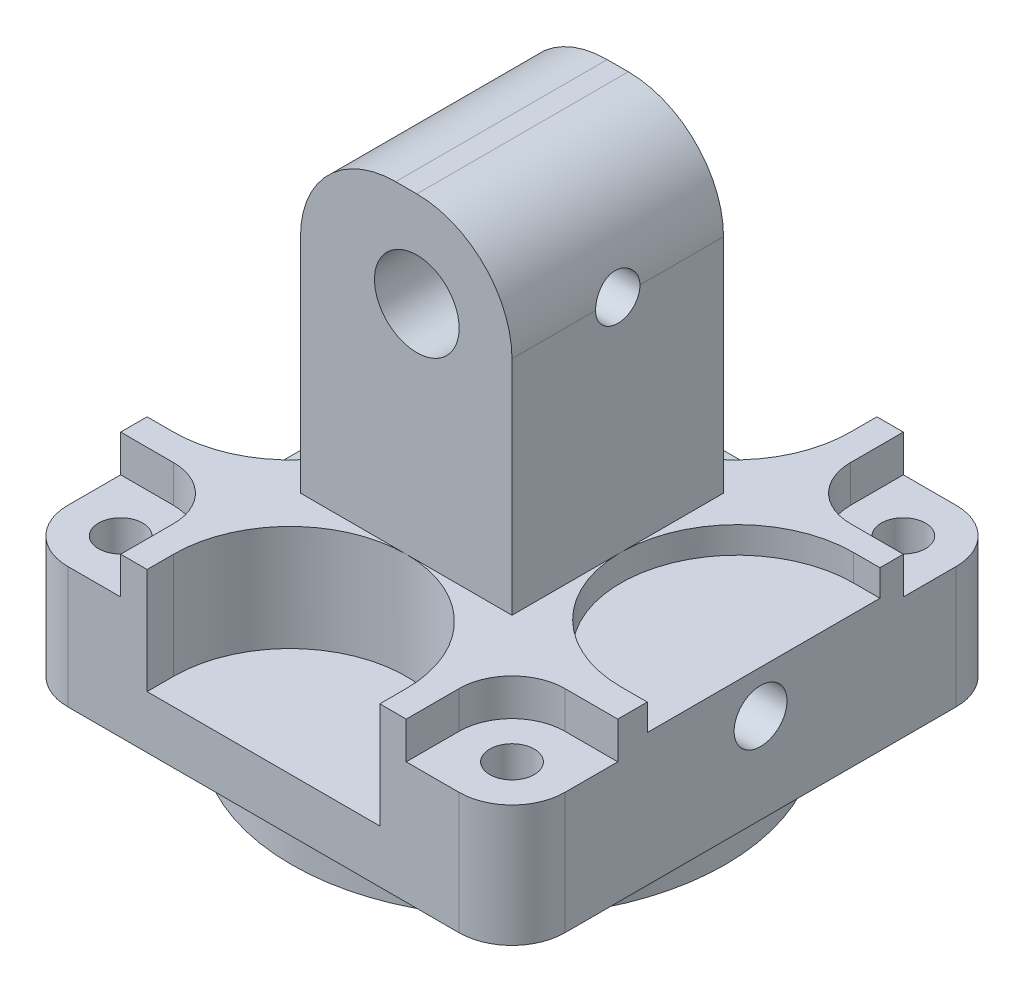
SolidWorks part; units mm, degrees
ref_plane "Plan de face" through (0, 0, 0) normal (0, 0, 1) x (1, 0, 0)
ref_plane "Plan de dessus" through (0, 0, 0) normal (0, 1, 0) x (1, 0, 0)
ref_plane "Plan de droite" through (0, 0, 0) normal (1, 0, 0) x (0, 0, -1)
sketch "Esquisse1" plane through (0, 0, 0) normal (0, 0, 1) x (1, 0, 0)
  line L1 (-23.5, 15) -> (23.5, 15)
  line L2 (-23.5, 15) -> (-23.5, 0)
  line L3 (-23.5, 0) -> (23.5, 0)
  line L4 (23.5, 15) -> (23.5, 0)
  dimension "D1" = 47
  dimension "D2" = 23.5
  dimension "D3" = 15
extrude "Extrusion1" add sketch "Esquisse1" along normal blind 47
sketch "Esquisse2" plane through (0, 0, 0) normal (0, -1, 0) x (1, 0, 0)
  circle A0 centre (0, 23.8473) radius 20.5
  dimension "D1" = 41
extrude "Extrusion2" add sketch "Esquisse2" along normal blind 5
sketch "Esquisse3" plane through (0, -5, 0) normal (0, -1, 0) x (1, 0, 0)
  circle A0 centre (0, 23.8473) radius 9.75
  dimension "D1" = 19.5
extrude "Extrusion3" add sketch "Esquisse3" along normal blind 3.5
sketch "Esquisse9" plane through (0, 15, 0) normal (0, 1, 0) x (-1, 0, 0)
  line L0 (0, -5.7773) -> (0, 143.899) construction
  line L1 (0, 23.5) -> (-77.8064, 23.5) construction
  line L2 (11, 2.5) -> (11, 0)
  line L3 (-11, 2.5) -> (-11, 0)
  line L4 (0, 23.5) -> (84.5721, 23.5) construction
  line L5 (-23.5, 0) -> (23.5, 0) construction
  line L6 (-11, 0) -> (11, 0)
  line L8 (-11, 44.5) -> (-11, 47)
  line L9 (21, 34.5) -> (23.5, 34.5)
  line L10 (-23.5, 47) -> (23.5, 47) construction
  line L11 (23.5, 47) -> (23.5, 0) construction
  line L12 (21, 12.5) -> (23.5, 12.5)
  line L13 (-11, 47) -> (11, 47)
  line L14 (23.5, 12.5) -> (23.5, 34.5)
  line L15 (11, 47) -> (11, 44.5)
  arc A3 (21, 34.5) -> (21, 12.5) centre (21, 23.5) ccw
  arc A4 (11, 2.5) -> (-11, 2.5) centre (0, 2.5) ccw
  arc A5 (-11, 44.5) -> (11, 44.5) centre (0, 44.5) ccw
  dimension "D1" = 22
  dimension "D2" = 22
  dimension "D3" = 22
  dimension "D4" = 2.5
  dimension "D5" = 2.5
  dimension "D6" = 2.5
extrude "Enlèv. mat.-Extru.4" cut sketch "Esquisse9" against normal blind 10
sketch "Esquisse10" plane through (0, 15, 0) normal (0, 1, 0) x (-1, 0, 0)
  line L1 (-20.998, 34.2115) -> (-23.5, 34.2115)
  line L2 (-23.5, 47) -> (-23.5, 0) construction
  line L3 (-20.998, 12.2115) -> (-23.5, 12.2115)
  line L4 (-23.5, 12.2115) -> (-23.5, 34.2115)
  line L5 (22, 23.2115) -> (-54.4829, 23.2115) construction
  arc A2 (-20.998, 12.2115) -> (-20.998, 34.2115) centre (-20.998, 23.2115) ccw
  dimension "D1" = 22
  dimension "D2" = 2.502
extrude "Enlèv. mat.-Extru.5" cut sketch "Esquisse10" against normal blind 2.5
fillet "Congé1" radius 5 4 edges at (-23.5, 7.5, 47) (23.5, 7.5, 47) (23.5, 7.5, 0) (-23.5, 7.5, 0)
sketch "Esquisse12" plane through (0, 15, 0) normal (0, 1, 0) x (-1, 0, 0)
  line L0 (-18.5, -19.8609) -> (-18.5, 147.4969) construction
  line L1 (-77.3053, 42) -> (75.0437, 42) construction
  line L2 (-74.6633, 5) -> (76.041, 5) construction
  line L3 (18.5, -17.0081) -> (18.5, 151.795) construction
  arc A0 (-18.5, 47) -> (-23.5, 42) centre (-18.5, 42) ccw construction
  circle A1 centre (-18.5, 5) radius 2.1
  circle A2 centre (-18.5, 42) radius 2.1
  circle A4 centre (18.5, 42) radius 2.1
  circle A5 centre (18.5, 5) radius 2.1
  arc A7 (18.5, 0) -> (23.5, 5) centre (18.5, 5) ccw construction
  dimension "D5" = 4.2
  dimension "D6" = 4.2
  dimension "D7" = 4.2
  dimension "D8" = 4.2
extrude "Enlèv. mat.-Extru.6" cut sketch "Esquisse12" against normal through all
sketch "Esquisse14" plane through (0, 0, 0) normal (1, 0, 0) x (0, 0, -1)
  line L1 (-29.0973, 11.5) -> (-29.0973, -8.5)
  line L2 (-33.5973, -8.5) -> (-14.0973, -8.5) construction
  line L4 (-29.0973, 11.5) -> (-23.8473, 11.5)
  line L5 (-29.0973, -8.5) -> (-23.8473, -8.5)
  line L6 (-23.8473, 11.5) -> (-23.8473, -8.5)
  dimension "D1" = 5.25
  dimension "D3" = 20
revolve "Enlèvement de matière-Révolution1" cut sketch "Esquisse14" angle 360 about L6
hole_wizard "Trou taraudé M61" positions "Esquisse3D1" profile "Esquisse15" tap size "M6" standard "ISO"
sketch3d "Esquisse3D1"
  point P0 (23.5, 8.5, 23.5)
  point P1 (0, 21.2253, 55.0476)
  point P3 (0, 22.6151, 58.9662)
  point P5 (0, 20.7216, 58.6849)
  dimension "D1" = 23.5
  dimension "D2" = 8.5
sketch "Esquisse15" plane through (23.5, 8.5, 23.5) normal (0, 1, 0) x (0, 0, -1)
  line L0 (0, 0) -> (0, 20.5022)
  line L1 (0, 20.5022) -> (2.5, 19)
  line L2 (2.5, 19) -> (2.5, 0)
  line L5 (2.5, 0) -> (0, 0)
  line L10 (0, 20.5022) -> (-2.5, 19) construction
  line L11 (0, -6.35) -> (0, 107.95) construction
  dimension "Diamètre du trou pour taraudage" = 5
  dimension "Profondeur du trou pour taraudage" = 19
  dimension "Angle de pointe" = 118
sketch "Esquisse16" plane through (0, 15, 0) normal (0, 1, 0) x (1, 0, 0)
  line L0 (18.5, -37) -> (23.5, -37)
  line L1 (23.5, -42) -> (23.5, -34.2115) construction
  line L2 (23.5, -37) -> (23.5, -42)
  line L3 (13.5, -42) -> (13.5, -47)
  line L4 (18.5, -47) -> (11, -47) construction
  line L5 (13.5, -47) -> (18.5, -47)
  line L6 (-13.5, -42) -> (-13.5, -47)
  line L7 (-11, -47) -> (-18.5, -47) construction
  line L8 (-13.5, -47) -> (-18.5, -47)
  line L9 (-18.5, -37) -> (-23.5, -37)
  line L12 (-23.5, -37) -> (-23.5, -42)
  line L13 (18.5, -10) -> (23.5, -10)
  line L14 (23.5, -12.2115) -> (23.5, -5) construction
  line L15 (23.5, -10) -> (23.5, -5)
  line L16 (13.5, -5) -> (13.5, 0)
  line L19 (13.5, 0) -> (18.5, 0)
  line L20 (-13.5, -5) -> (-13.5, 0)
  line L21 (-11, 0) -> (-18.5, 0) construction
  line L22 (-13.5, 0) -> (-18.5, 0)
  line L23 (-18.5, -10) -> (-23.5, -10)
  line L24 (-23.5, -12.5) -> (-23.5, -5) construction
  line L25 (-23.5, -10) -> (-23.5, -5)
  arc A0 (18.5, -47) -> (23.5, -42) centre (18.5, -42) ccw
  arc A1 (18.5, -37) -> (13.5, -42) centre (18.5, -42) ccw
  arc A2 (-13.5, -42) -> (-18.5, -37) centre (-18.5, -42) ccw
  arc A3 (-23.5, -42) -> (-18.5, -47) centre (-18.5, -42) ccw
  arc A4 (23.5, -5) -> (18.5, 0) centre (18.5, -5) ccw
  arc A5 (13.5, -5) -> (18.5, -10) centre (18.5, -5) ccw
  arc A6 (-18.5, 0) -> (-23.5, -5) centre (-18.5, -5) ccw
  arc A7 (-18.5, -10) -> (-13.5, -5) centre (-18.5, -5) ccw
  dimension "D1" = 10
extrude "Extrusion5" cut sketch "Esquisse16" against normal blind 3.5
sketch "Esquisse17" plane through (0, 15, 0) normal (0, 1, 0) x (1, 0, 0)
  line L0 (-18.5, 0) -> (18.5, 0) construction
  line L1 (-10, -13.5) -> (10, -13.5)
  line L2 (-10, -13.5) -> (-10, -33.5)
  line L3 (-10, -33.5) -> (10, -33.5)
  line L4 (10, -13.5) -> (10, -33.5)
  line L5 (11, 0) -> (-11, 0) construction
  point P4 (0, 0)
  dimension "D1" = 20
  dimension "D2" = 10
  dimension "D3" = 20
  dimension "D4" = 13.5
extrude "Extrusion6" add sketch "Esquisse17" along normal blind 30
fillet "Congé2" radius 9 2 edges at (10, 45, 23.5) (-10, 45, 23.5)
sketch "Esquisse18" plane through (0, 0, 33.5) normal (0, 0, 1) x (1, 0, 0)
  circle A0 centre (1, 36) radius 4
  dimension "D1" = 8
extrude "Extrusion7" cut sketch "Esquisse18" against normal through all
ref_plane "Plan1" through (10, 36, 13.5) normal (1, 0, 0) x (0, 0, -1)
sketch "Esquisse19" plane through (10, 0, 0) normal (1, 0, 0) x (0, 0, -1)
  line L0 (-13.5, 36) -> (-33.5, 36) construction
  circle A0 centre (-23.5, 36) radius 2.1
  dimension "D1" = 4.2
extrude "Extrusion8" cut sketch "Esquisse19" against normal blind 10
